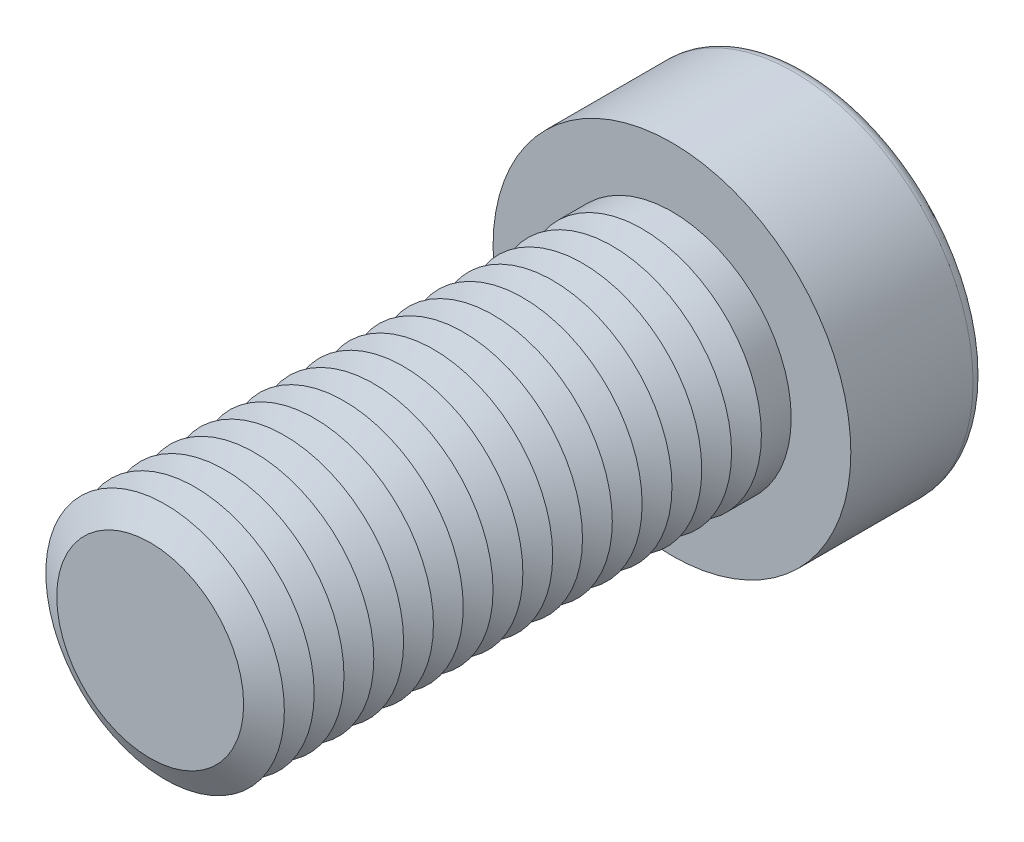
SolidWorks part; units mm, degrees
ref_plane "Front Plane" through (0, 0, 0) normal (0, 0, 1) x (1, 0, 0)
ref_plane "Top Plane" through (0, 0, 0) normal (0, 1, 0) x (1, 0, 0)
ref_plane "Right Plane" through (0, 0, 0) normal (1, 0, 0) x (0, 0, -1)
sketch "Sketch1" plane through (0, 0, 0) normal (0, 0, 1) x (1, 0, 0)
  circle A0 centre (0, 0) radius 8
  dimension "D1" = 16
extrude "Boss-Extrude1" add sketch "Sketch1" along normal blind 35
sketch "Sketch2" plane through (0, 0, 0) normal (0, 0, -1) x (-1, 0, 0)
  circle A0 centre (0, 0) radius 12
  dimension "D1" = 24
extrude "Boss-Extrude2" add sketch "Sketch2" along normal blind 9
sketch "Sketch3" plane through (0, 0, -9) normal (0, 0, -1) x (-1, 0, 0)
  line L1 (-3.4641, 6) -> (-6.9282, 0)
  line L2 (-6.9282, 0) -> (-3.4641, -6)
  line L3 (-3.4641, -6) -> (3.4641, -6)
  line L4 (3.4641, -6) -> (6.9282, 0)
  line L5 (6.9282, 0) -> (3.4641, 6)
  line L6 (3.4641, 6) -> (-3.4641, 6)
  circle A0 centre (0, 0) radius 6 construction
  dimension "D1" = 12
extrude "Cut-Extrude1" cut sketch "Sketch3" against normal blind 9
fillet "Fillet1" radius 0.8 1 edges at (-12, 0, -9)
sketch "Sketch4" plane through (0, 0, 0) normal (0, 0, -1) x (-1, 0, 0)
  line L0 (3.4641, -6) -> (6.9282, 0) construction
  circle A0 centre (0, 0) radius 6
extrude "Cut-Extrude2" cut sketch "Sketch4" against normal through all draft 60
sketch "Sketch5" plane through (0, 0, -9) normal (0, 0, -1) x (-1, 0, 0)
  circle A0 centre (0, 0) radius 6.9282
extrude "Cut-Extrude3" cut sketch "Sketch5" against normal through all draft 75
sketch "Sketch7" plane through (0, 0, 0) normal (1, 0, 0) x (0, 0, -1)
  line L25 (-35, 6.2679) -> (-34, 8)
  line L26 (-35, 8) -> (-35, -8) construction
  line L27 (-34, 8) -> (-36, 8)
  line L28 (-36, 8) -> (-35, 6.2679)
  line L29 (0, 8) -> (-35, 8) construction
  dimension "D1" = 2
revolve "Cut-Revolve1" cut sketch "Sketch7" angle 360 about axis through (0, 0, 35) along (0, 0, -1)
pattern_linear "LPattern1" count 17 spacing 2 along (0, 0, -1) of "Cut-Revolve1"
